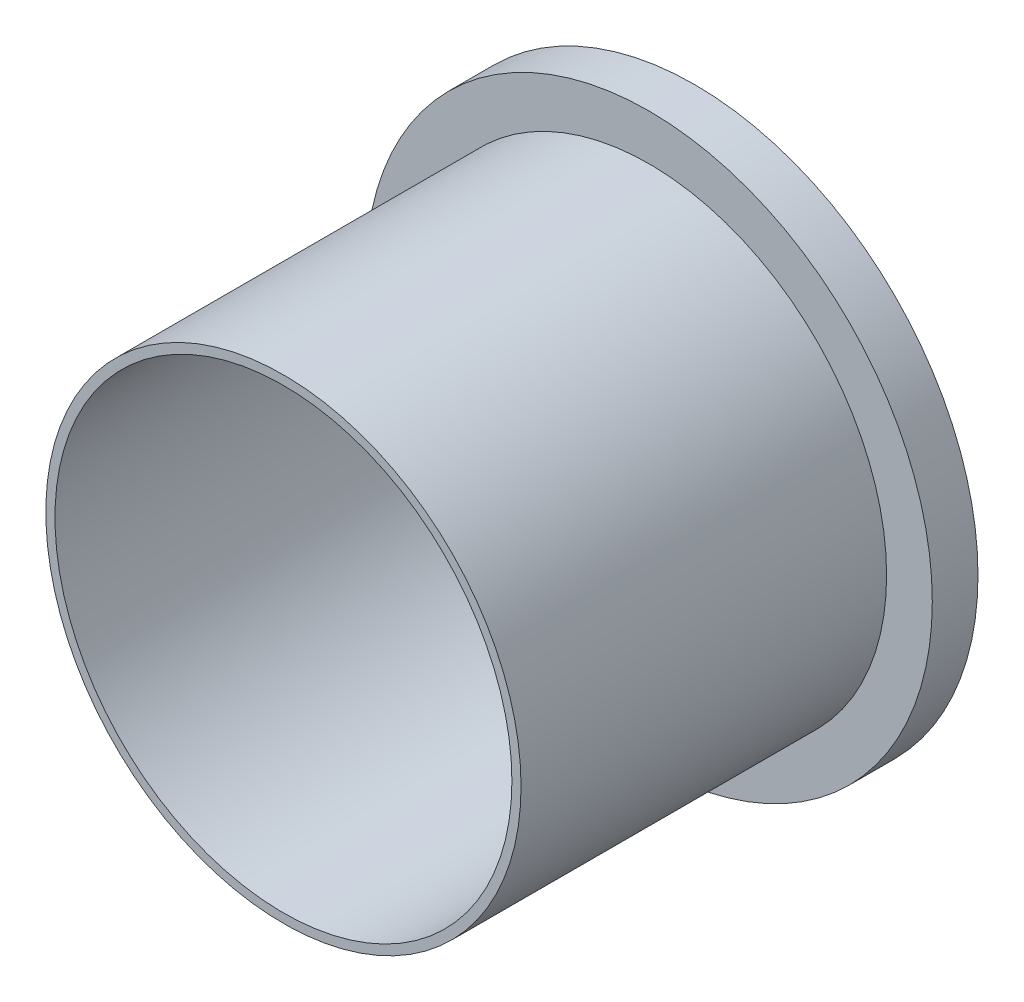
SolidWorks part; units mm, degrees
ref_plane "Alzado" through (0, 0, 0) normal (0, 0, 1) x (1, 0, 0)
ref_plane "Planta" through (0, 0, 0) normal (0, 1, 0) x (1, 0, 0)
ref_plane "Vista lateral" through (0, 0, 0) normal (1, 0, 0) x (0, 0, -1)
sketch "Croquis1" plane through (0, 0, 0) normal (0, 0, 1) x (1, 0, 0)
  circle A0 centre (0, 0) radius 31
  dimension "D1" = 62
extrude "Saliente-Extruir1" add sketch "Croquis1" along normal blind 5
sketch "Croquis2" plane through (0, 0, 5) normal (0, 0, 1) x (1, 0, 0)
  circle A2 centre (0, 0) radius 26
  circle A3 centre (0, 0) radius 26
  dimension "D1" = 5
extrude "Saliente-Extruir2" add sketch "Croquis2" along normal blind 40
sketch "Croquis3" plane through (0, 0, 45) normal (0, 0, 1) x (1, 0, 0)
  circle A2 centre (0, 0) radius 25
  circle A3 centre (0, 0) radius 25
  dimension "D1" = 1
extrude "Cortar-Extruir1" cut sketch "Croquis3" against normal up to surface (40 mm away)
ref_plane "Plano2" through (0, 0, -2.5) normal (0, 0, -1) x (-1, 0, 0)
sketch "Croquis10" plane through (0, 0, -2.5) normal (0, 0, -1) x (-1, 0, 0)
  line L0 (0, 2.2395) -> (0, -27.7605) construction
  line L1 (0, 2.2395) -> (0, -27.7605)
  ellipse E0 centre (0, -12.7605) end of major axis (0, -27.7605) minor radius 7 (0, 2.2395) -> (0, -27.7605) ccw
  dimension "D1" = 7
  dimension "D2" = 30
revolve "Cortar-Revolución19" cut sketch "Croquis10" angle 360 about L0
sketch "Croquis11" plane through (0, 0, 0) normal (0, 0, -1) x (-1, 0, 0)
  line L0 (0, 0) -> (0, -5)
  line L1 (5.4438, -5) -> (-5.4438, -5)
  spline S0 degree 3 number of poles 95 (0, -26.7712) -> (0, -26.7712) construction
  point P7 (0, -5)
ref_plane "Plano3" through (0, -2.5, -2.5) normal (0, -0.7071, -0.7071) x (1, 0, 0)
sketch "Croquis12" plane through (0, -2.5, -2.5) normal (0, -0.7071, -0.7071) x (1, 0, 0)
  circle A0 centre (0, 3.5355) radius 8.7611
extrude "Saliente-Extruir3" add sketch "Croquis12" against normal up to surface
sketch "Croquis13" plane through (0, 0, 0) normal (1, 0, 0) x (0, 0, -1)
  line L0 (0, -31) -> (0, 31) construction
  line L1 (0, 7.29) -> (9.143, 7.29)
  line L2 (0, 7.29) -> (0, -13.7262)
  line L3 (0, -13.7262) -> (9.143, -13.7262)
  line L4 (9.143, 7.29) -> (9.143, -13.7262)
extrude "Cortar-Extruir2" cut sketch "Croquis13" against normal through all both and the other way through all
